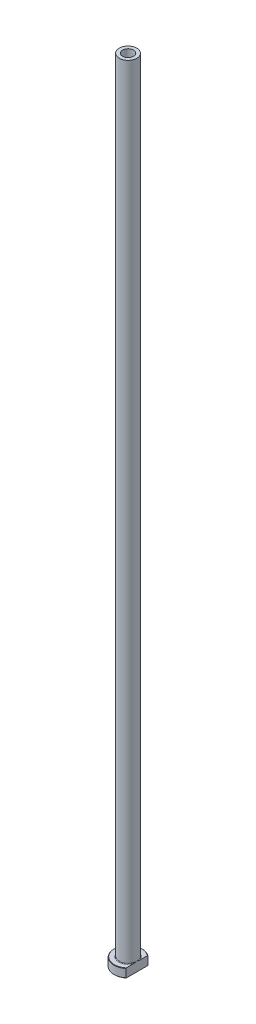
SolidWorks part; units mm, degrees
ref_plane "Front Plane" through (0, 0, 0) normal (0, 0, 1) x (1, 0, 0)
ref_plane "Top Plane" through (0, 0, 0) normal (0, 1, 0) x (1, 0, 0)
ref_plane "Right Plane" through (0, 0, 0) normal (1, 0, 0) x (0, 0, -1)
sketch "Sketch1" plane through (0, 0, 0) normal (0, 0, 1) x (1, 0, 0)
  line L0 (-3.1, 450) -> (-5, 450)
  line L1 (-5, 450) -> (-5, 5)
  line L2 (-5, 5) -> (-8, 5)
  line L3 (-8, 5) -> (-8, 0)
  line L4 (7.15, 0) -> (-7.15, 0) construction
  line L5 (-8, 0) -> (-3.35, 0)
  line L6 (-3.1, 405) -> (-3.1, 450)
  line L7 (0, 92.1877) -> (0, -15.5353) construction
  line L8 (0, -8.8) -> (0, 8.8) construction
  line L9 (-3.1, 405) -> (-3.35, 393)
  line L10 (-3.35, 393) -> (-3.35, 0)
  dimension "D1" = 0.25
  dimension "ID" = 6.2
  dimension "OD" = 10
  dimension "L" = 450
  dimension "H" = 16
  dimension "T" = 5
  dimension "N" = 45
  dimension "D2" = 12
  dimension "L-N" = 405
revolve "Revolve1" add sketch "Sketch1" angle 360 about L7
fillet "Fillet1" radius 0.3 1 edges at (0, 5, 5)
chamfer "Chamfer1" distance 0.2 angle 45 2 edges at (0, 5, 8) (0, 0, 8)
sketch "Sketch2" plane through (0, 0, 0) normal (0, -1, 0) x (1, 0, 0)
  line L0 (5, 6.245) -> (5, -6.245)
  circle A0 centre (0, 0) radius 8 construction
  arc A1 (5, 6.245) -> (5, -6.245) centre (0, 0) cw
  circle A2 centre (0, 0) radius 5 construction
extrude "Cut-Extrude1" cut sketch "Sketch2" against normal through all
chamfer "Chamfer2" distance 0.5 angle 45 1 edges at (0, 0, 3.35)
